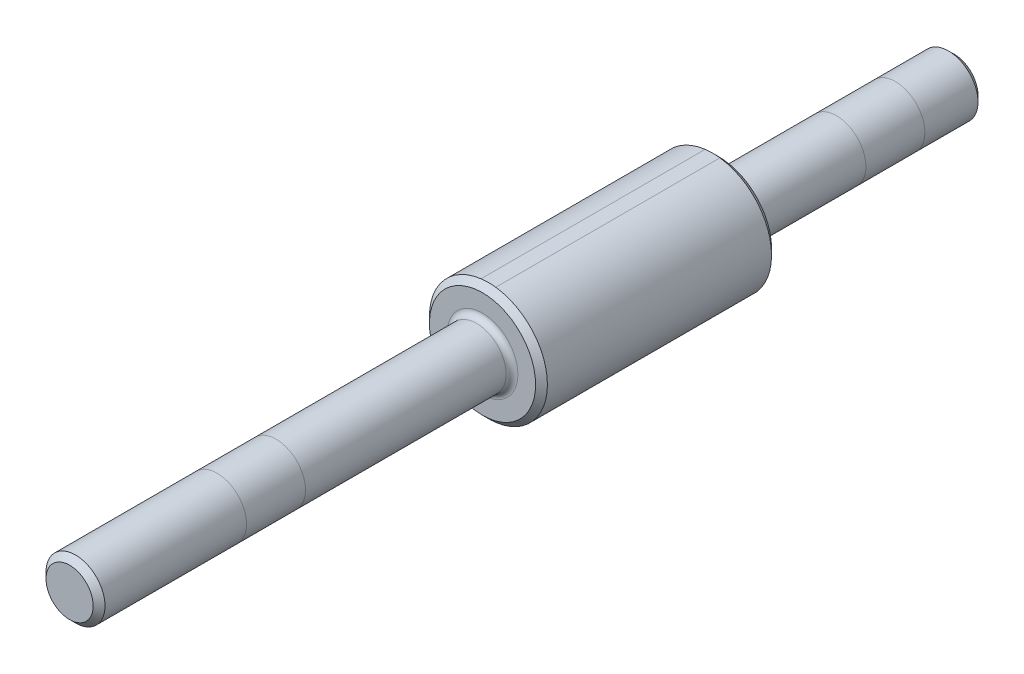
SolidWorks part; units mm, degrees
ref_plane "Front Plane" through (0, 0, 0) normal (0, 0, 1) x (1, 0, 0)
ref_plane "Top Plane" through (0, 0, 0) normal (0, 1, 0) x (1, 0, 0)
ref_plane "Right Plane" through (0, 0, 0) normal (1, 0, 0) x (0, 0, -1)
sketch "Sketch1" plane through (0, 0, 0) normal (0, 0, 1) x (1, 0, 0)
  circle A0 centre (0, 0) radius 5
  dimension "D1" = 10
extrude "Boss-Extrude1" add sketch "Sketch1" along normal blind 150
ref_plane "Plane1" through (0, 0, 40) normal (0, 0, 1) x (1, 0, 0)
sketch "Sketch2" plane through (0, 0, 40) normal (0, 0, 1) x (1, 0, 0)
  circle A0 centre (0, 0) radius 10
  dimension "D1" = 20
extrude "Boss-Extrude2" add sketch "Sketch2" along normal blind 40
fillet "Fillet1" radius 1 2 edges at (5, 0, 80) (5, 0, 40)
chamfer "Chamfer1" distance 1 angle 45 4 edges at (5, 0, 0) (10, 0, 80) (5, 0, 150) (10, 0, 40)
sketch "Sketch3" plane through (0, 0, 0) normal (0, 1, 0) x (1, 0, 0)
  line L0 (0, 0) -> (0, -156.2676) construction
  line L1 (10, -41) -> (-10, -41) construction
  line L2 (-1.25, -41) -> (1.25, -41)
  line L3 (-1.25, -41) -> (-1.25, -79)
  line L4 (-1.25, -79) -> (1.25, -79)
  line L5 (1.25, -41) -> (1.25, -79)
  line L6 (10, -79) -> (-10, -79) construction
  dimension "D1" = 2.5
  dimension "D2" = 1.25
sketch "Sketch4" plane through (0, 0, 0) normal (0, 1, 0) x (1, 0, 0)
  line L0 (0, 0) -> (0, -24.7142) construction
  line L3 (-7.5, -10) -> (7.5, -10)
  line L4 (-7.5, -10) -> (-7.5, -20)
  line L5 (-7.5, -20) -> (7.5, -20)
  line L6 (7.5, -10) -> (7.5, -20)
  line L9 (4, 0) -> (-4, 0) construction
  dimension "D1" = 10
  dimension "D2" = 10
  dimension "D3" = 15
  dimension "D4" = 7.5
sketch "Sketch5" plane through (0, 0, 0) normal (0, 1, 0) x (1, 0, 0)
  line L0 (0, -150) -> (0, -102.092) construction
  line L1 (-4, -150) -> (4, -150) construction
  line L3 (-7.5, -115) -> (7.5, -115)
  line L4 (-7.5, -115) -> (-7.5, -125)
  line L5 (-7.5, -125) -> (7.5, -125)
  line L6 (7.5, -115) -> (7.5, -125)
  dimension "D1" = 10
  dimension "D2" = 15
  dimension "D3" = 7.5
  dimension "D4" = 25
